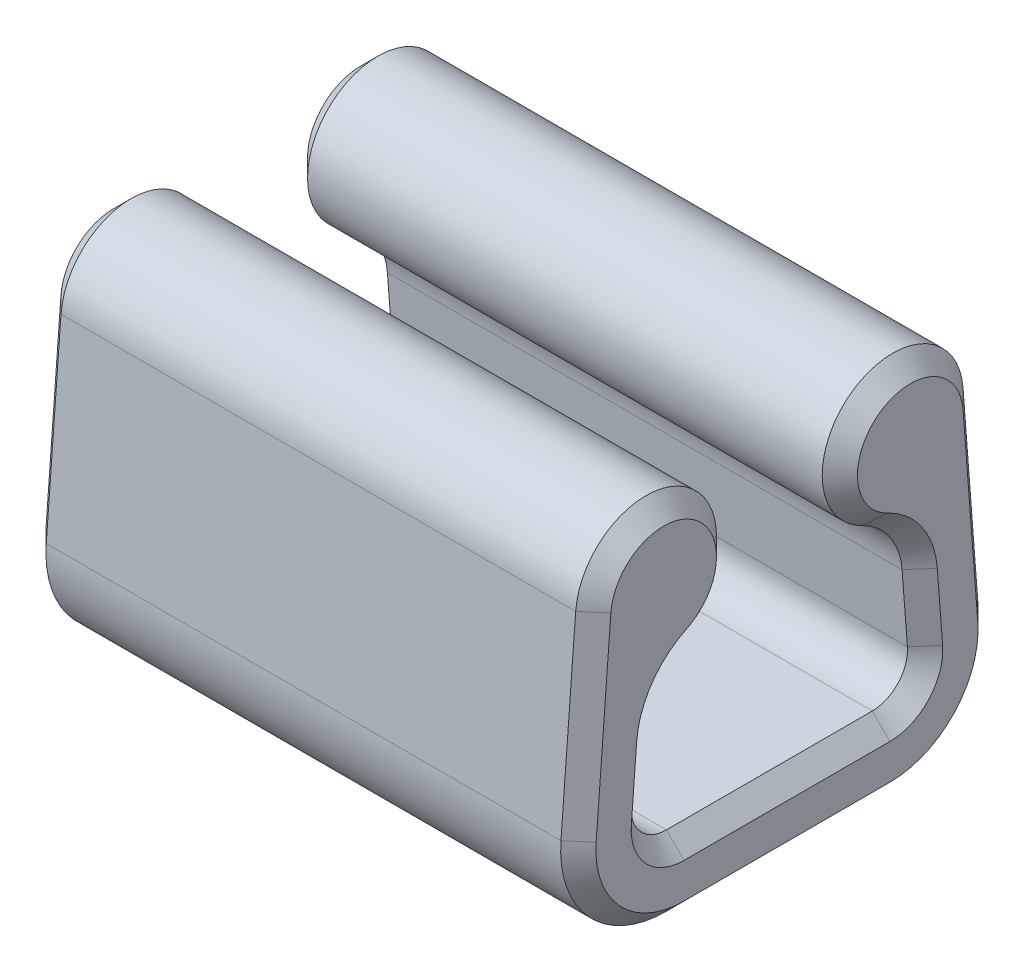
SolidWorks part; units mm, degrees
ref_plane "Plan de face" through (0, 0, 0) normal (0, 0, 1) x (1, 0, 0)
ref_plane "Plan de dessus" through (0, 0, 0) normal (0, 1, 0) x (1, 0, 0)
ref_plane "Plan de droite" through (0, 0, 0) normal (1, 0, 0) x (0, 0, -1)
sketch "Esquisse1" plane through (0, 0, 0) normal (1, 0, 0) x (0, 0, -1)
  line L0 (0, 0) -> (2.92, 0)
  line L1 (5.9112, 3.2302) -> (5.4938, 8.6541)
  line L2 (3.7655, 5.0468) -> (3.9171, 3.0767)
  line L3 (2.92, 2) -> (0, 2)
  line L4 (0, 2) -> (0, 0)
  arc A0 (2.92, 0) -> (5.9112, 3.2302) centre (2.92, 3) ccw
  arc A1 (5.4938, 8.6541) -> (2.6355, 6.697) centre (3.4997, 8.5007) ccw
  arc A2 (2.6355, 6.697) -> (3.7655, 5.0468) centre (1.7714, 4.8934) cw
  arc A3 (3.9171, 3.0767) -> (2.92, 2) centre (2.92, 3) cw
  dimension "D1" = 2.92
  dimension "D4" = 5.44
  dimension "D5" = 2
  dimension "D6" = 3
  dimension "D2" = 2
  dimension "D3" = 85.6
  dimension "D8" = 2
extrude "Boss.-Extru.1" add sketch "Esquisse1" along normal mid plane 15.6
mirror "Symétrie1" about plane through (0, 0, 0) normal (0, 0, 1) of "Boss.-Extru.1"
chamfer "Chanfrein1" distance 0.5 angle 45 28 edges at (-7.8, 0.9617, -5.1212) (-7.8, 5.9421, -5.7025) (-7.8, 10.1509, -2.3698) (-7.8, 6.0233, -3.4216) (-7.8, 4.0618, -3.8413) (-7.8, 2.3206, -3.6537) (-7.8, 2, 0) (-7.8, 2.3206, 3.6537) (7.8, 2.3206, 3.6537) (-7.8, 4.0618, 3.8413) (7.8, 4.0618, 3.8413) (-7.8, 6.0233, 3.4216) (7.8, 6.0233, 3.4216) (-7.8, 10.1509, 2.3698) (7.8, 10.1509, 2.3698) (-7.8, 5.9421, 5.7025) (7.8, 5.9421, 5.7025) (-7.8, 0.9617, 5.1212) (7.8, 0.9617, 5.1212) (-7.8, 0, 0) (7.8, 2.3206, -3.6537) (7.8, 4.0618, -3.8413) (7.8, 6.0233, -3.4216) (7.8, 10.1509, -2.3698) (7.8, 5.9421, -5.7025) (7.8, 0.9617, -5.1212) (7.8, 0, 0) (7.8, 2, 0)
